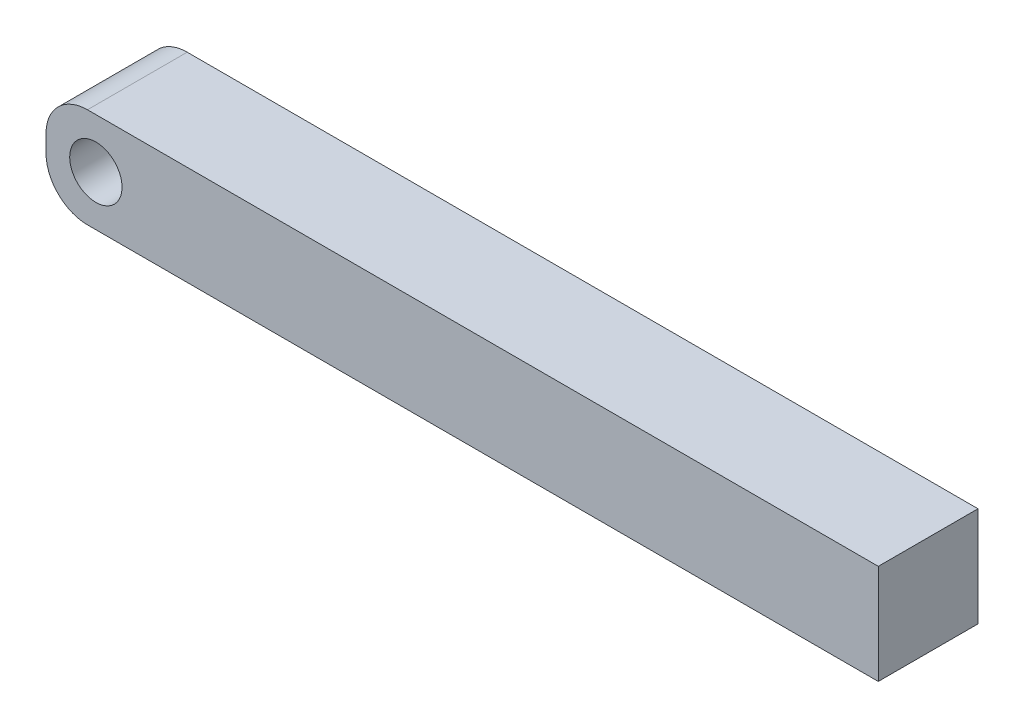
SolidWorks part; units mm, degrees
ref_plane "Front Plane" through (0, 0, 0) normal (0, 0, 1) x (1, 0, 0)
ref_plane "Top Plane" through (0, 0, 0) normal (0, 1, 0) x (1, 0, 0)
ref_plane "Right Plane" through (0, 0, 0) normal (1, 0, 0) x (0, 0, -1)
sketch "Sketch1" plane through (0, 0, 0) normal (0, 0, 1) x (1, 0, 0)
  line L0 (0, 0) -> (68.8102, 0) construction
  line L1 (-9.525, -9.525) -> (149.479, -9.525)
  line L2 (149.479, -9.525) -> (149.479, 9.525)
  line L3 (149.479, 9.525) -> (-9.525, 9.525)
  line L4 (-9.525, 9.525) -> (-9.525, -9.525)
  circle A0 centre (0, 0) radius 5
  dimension "D1" = 10
  dimension "D2" = 19.05
  dimension "D3" = 9.525
  dimension "D4" = 159.004
extrude "Boss-Extrude1" add sketch "Sketch1" along normal mid plane 19.05
fillet "Fillet1" radius 7.9248 2 edges at (-9.525, -9.525, 0) (-9.525, 9.525, 0)
